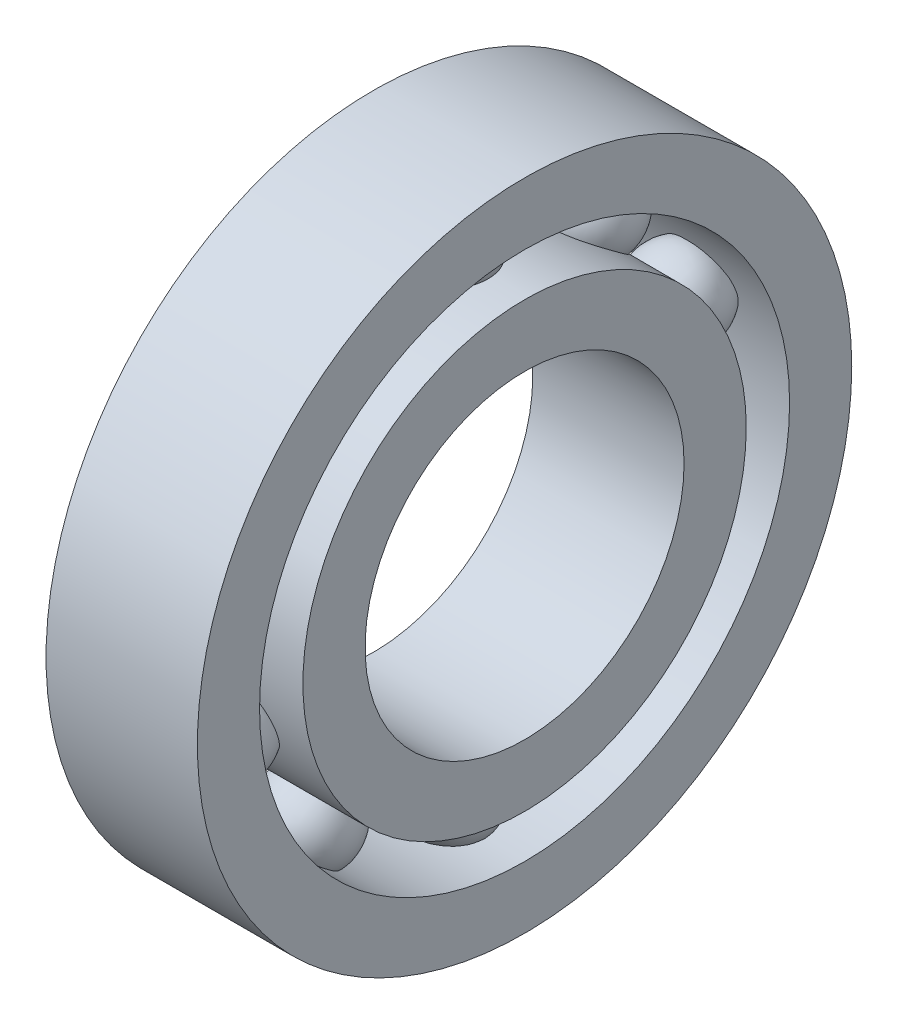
SolidWorks part; units mm, degrees
ref_plane "Front Plane" through (0, 0, 0) normal (0, 0, 1) x (1, 0, 0)
ref_plane "Top Plane" through (0, 0, 0) normal (0, 1, 0) x (1, 0, 0)
ref_plane "Right Plane" through (0, 0, 0) normal (1, 0, 0) x (0, 0, -1)
sketch "Sketch1" plane through (0, 0, 0) normal (0, 0, 1) x (1, 0, 0)
  line L0 (-37, 39) -> (0, 39)
  line L1 (-26.4722, 39) -> (-26.4722, 80) construction
  line L2 (-10.5278, 39) -> (-10.5278, 80) construction
  line L3 (-37, 80) -> (0, 80)
  line L4 (0, 39) -> (0, 54.2)
  line L5 (0, 0) -> (-65, 0) construction
  line L6 (-37, 64.8) -> (0, 64.8)
  line L7 (-37, 80) -> (-37, 64.8)
  line L8 (-37, 54.2) -> (0, 54.2)
  line L9 (0, 64.8) -> (0, 80)
  line L10 (-37, 54.2) -> (-37, 39)
  line L11 (-26.4722, 59.5) -> (-10.5278, 59.5) construction
  line L12 (-18.5, 59.5) -> (-18.5, 80) construction
  dimension "D1" = 10.6
  dimension "D2" = 39
  dimension "D3" = 80
  dimension "D7" = 37
revolve "Revolve1" add sketch "Sketch1" angle 360 about L5
sketch "Sketch2" plane through (0, 0, 0) normal (0, 0, 1) x (1, 0, 0)
  line L0 (0, 0) -> (-37, 0) construction
  line L3 (-18.5, 0) -> (-18.5, 58.75) construction
  line L4 (-7.85, 58.75) -> (-29.15, 58.75)
  line L5 (-7.85, 58.75) -> (-29.15, 58.75) construction
  line L6 (-37, 80) -> (-37, -80) construction
  arc A0 (-7.85, 58.75) -> (-29.15, 58.75) centre (-18.5, 58.75) ccw
  dimension "D1" = 21.3
  dimension "D2" = 58.75
revolve "Revolve3" add sketch "Sketch2" angle 360 about L5
pattern_circular "CirPattern1" count 10 over 360 about axis through (0, 0, 0) along (1, 0, 0) of "Revolve3"
